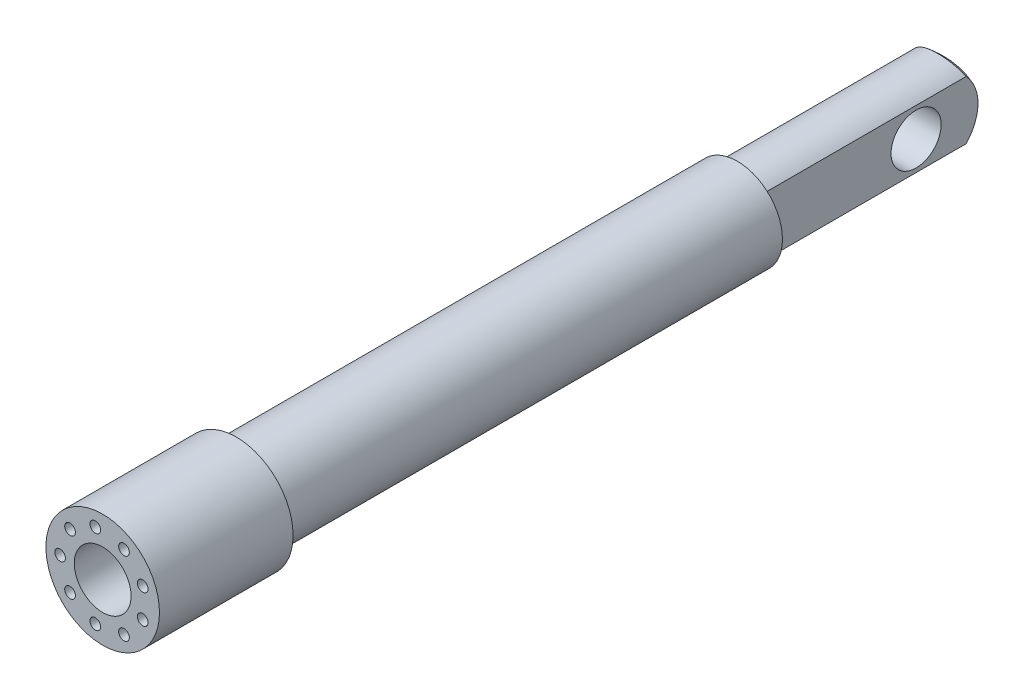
SolidWorks part; units mm, degrees
ref_plane "Front" through (0, 0, 0) normal (0, 0, 1) x (1, 0, 0)
ref_plane "Top" through (0, 0, 0) normal (0, 1, 0) x (1, 0, 0)
ref_plane "Right" through (0, 0, 0) normal (1, 0, 0) x (0, 0, -1)
sketch "Sketch1" plane through (0, 0, 0) normal (0, 0, 1) x (1, 0, 0)
  circle A0 centre (0, 0) radius 85
  dimension "D1" = 170
extrude "Extrude1" add sketch "Sketch1" against normal blind 200
sketch "Sketch2" plane through (0, 0, 0) normal (0, 0, 1) x (1, 0, 0)
  circle A1 centre (0, 0) radius 67.5
  dimension "D1" = 135
extrude "Extrude2" add sketch "Sketch2" against normal blind 950
sketch "Sketch3" plane through (0, 0, 0) normal (0, 0, 1) x (1, 0, 0)
  circle A0 centre (0, 0) radius 42.5
  dimension "D1" = 85
extrude "Cut-Extrude1" cut sketch "Sketch3" against normal offset from surface (920 mm away) 30
sketch "Sketch5" plane through (0, 0, 0) normal (0, 0, 1) x (1, 0, 0)
  line L0 (0, 0) -> (-63.75, 0) construction
  circle A0 centre (-63.75, 0) radius 8
  dimension "D2" = 16
  dimension "D1" = 63.75
extrude "Cut-Extrude2" cut sketch "Sketch5" against normal blind 85
pattern_circular "CirPattern1" count 9 every 40
sketch "Sketch12" plane through (0, 0, -950) normal (0, 0, -1) x (-1, 0, 0)
  circle A2 centre (0, 0) radius 57.5
  circle A3 centre (0, 0) radius 57.5
  dimension "D1" = 10
extrude "Extrude3" add sketch "Sketch12" along normal blind 350
sketch "Sketch14" plane through (0, 0, 0) normal (0, 1, 0) x (1, 0, 0)
  line L0 (37.5, 950) -> (37.5, 1300)
  line L1 (57.5, 1300) -> (37.5, 1300)
  line L2 (37.5, 950) -> (57.5, 950)
  line L3 (57.5, 950) -> (57.5, 1300) construction
  line L4 (57.5, 950) -> (57.5, 1300)
  line L5 (0, 1857.3677) -> (0, 1270.3814) construction
  line L6 (0, 200) -> (0, 0) construction
  line L7 (-57.5, 950) -> (-57.5, 1300)
  line L8 (-37.5, 950) -> (-57.5, 950)
  line L9 (-57.5, 1300) -> (-37.5, 1300)
  line L10 (-37.5, 950) -> (-37.5, 1300)
  dimension "D1" = 20
extrude "Cut-Extrude3" cut sketch "Sketch14" against normal mid plane 350
sketch "Sketch16" plane through (37.5, 0, 0) normal (1, 0, 0) x (0, 0, -1)
  line L3 (1300, 0) -> (1180, 0) construction
  line L8 (1300, 0) -> (950, 0) construction
  line L9 (1300, -43.589) -> (1300, 43.589) construction
  circle A0 centre (1180, 0) radius 37.5
  dimension "D1" = 120
  dimension "D2" = 75
extrude "Cut-Extrude5" cut sketch "Sketch16" against normal through all
sketch "Sketch18" plane through (0, 0, 0) normal (1, 0, 0) x (0, 0, -1)
  line L0 (1180, 80) -> (1180, -80) construction
  line L4 (1300, 0) -> (950, 0) construction
  line L21 (1180, -80) -> (1180, -97.5)
  line L22 (1180, 80) -> (1180, 97.5)
  line L39 (1340, -97.5) -> (1340, -43.589)
  line L40 (1340, -43.589) -> (1340, 43.589)
  line L41 (1340, 43.589) -> (1340, 97.5)
  line L42 (950, -97.5) -> (1340, -97.5)
  line L43 (1340, 97.5) -> (950, 97.5)
  line L44 (1340, -97.5) -> (1340, -43.589)
  line L45 (1340, -43.589) -> (1340, 43.589)
  line L46 (1340, 43.589) -> (1340, 97.5)
  line L47 (1180, -97.5) -> (1340, -97.5)
  line L48 (1340, 97.5) -> (1180, 97.5)
  circle A0 centre (1180, 0) radius 37.5 construction
  ellipse E0 centre (1180, 0) end of major axis (1080, 0) minor radius 80 (1180, -80) -> (1180, 80) ccw
  point P0 (1180, 0)
  dimension "D3" = 40
  dimension "D1" = 160
  dimension "D2" = 200
revolve "Cut-Revolve1" cut sketch "Sketch18" angle 180 about L0
